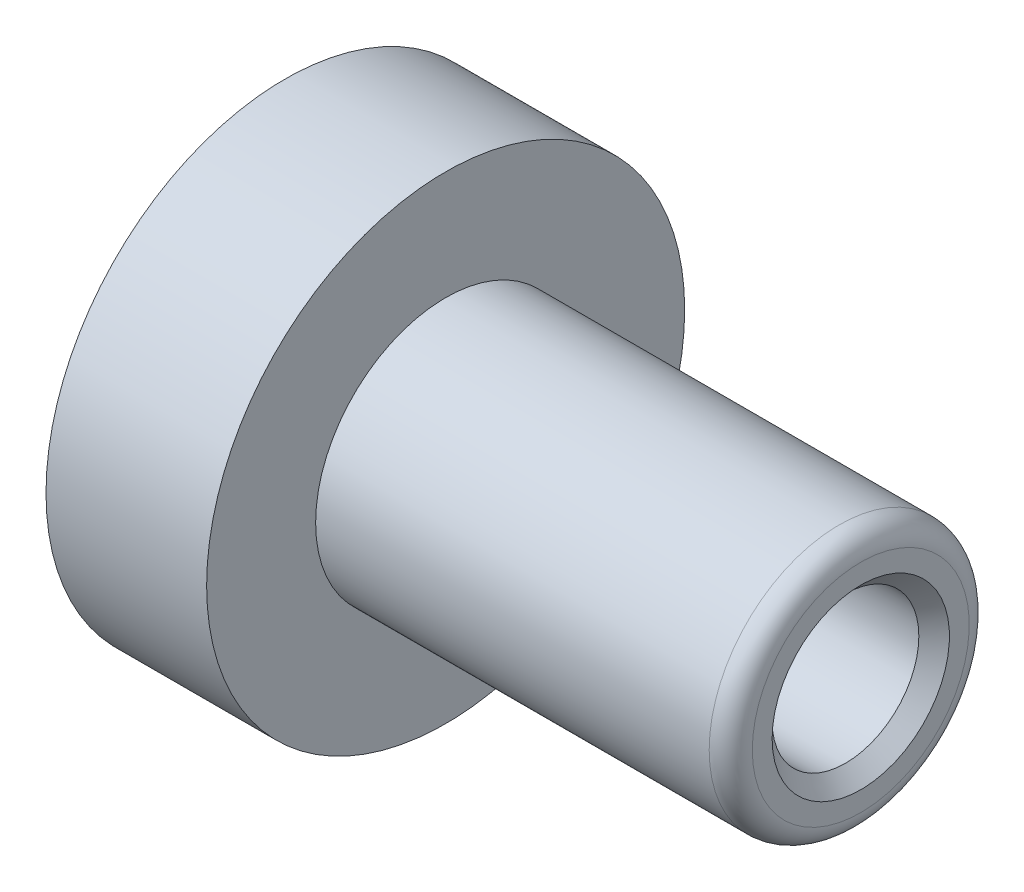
SolidWorks part; units mm, degrees
ref_plane "Front Plane" through (0, 0, 0) normal (0, 0, 1) x (1, 0, 0)
ref_plane "Top Plane" through (0, 0, 0) normal (0, 1, 0) x (1, 0, 0)
ref_plane "Right Plane" through (0, 0, 0) normal (1, 0, 0) x (0, 0, -1)
sketch "Sketch1" plane through (0, 0, 0) normal (0, 0, 1) x (1, 0, 0)
  line L0 (0, 0) -> (102.3864, 0) construction
  line L1 (0, 6.7437) -> (0, 17.4625)
  line L2 (0, 17.4625) -> (11.7348, 17.4625)
  line L3 (11.7348, 17.4625) -> (11.7348, 9.4996)
  line L4 (11.7348, 9.4996) -> (40.4876, 9.4996)
  line L5 (42.0624, 7.9248) -> (42.0624, 0)
  line L6 (42.0624, 0) -> (20.4724, 0)
  line L7 (0, 6.7437) -> (20.4724, 6.7437)
  line L8 (20.4724, 6.7437) -> (20.4724, 0)
  arc A0 (42.0624, 7.9248) -> (40.4876, 9.4996) centre (40.4876, 7.9248) ccw
  dimension "D5" = 1.5748
  dimension "D1" = 11.7348
  dimension "D2" = 34.925
  dimension "D3" = 20.4724
  dimension "D4" = 13.4874
  dimension "D6" = 42.0624
  dimension "D7" = 18.9992
revolve "Revolve1" add sketch "Sketch1" angle 360 about L0
sketch "Sketch2" plane through (0, 0, 0) normal (-1, 0, 0) x (0, 0, 1)
  line L0 (0, 0) -> (9.7644, 0) construction
  circle A0 centre (0, 11.1125) radius 1.6129
  circle A1 centre (0, -11.1125) radius 1.6129
  dimension "D2" = 3.2258
  dimension "D1" = 22.225
extrude "Cut-Extrude1" cut sketch "Sketch2" against normal blind 6.35
sketch "Sketch3" plane through (42.0624, 0, 0) normal (1, 0, 0) x (0, 0, -1)
  circle A0 centre (0, 0) radius 5.3594
  dimension "D1" = 10.7188
extrude "Cut-Extrude2" cut sketch "Sketch3" against normal blind 18.5674
chamfer "Chamfer1" distance 1.1176 angle 45 1 edges at (42.0624, 0, -5.3594)
